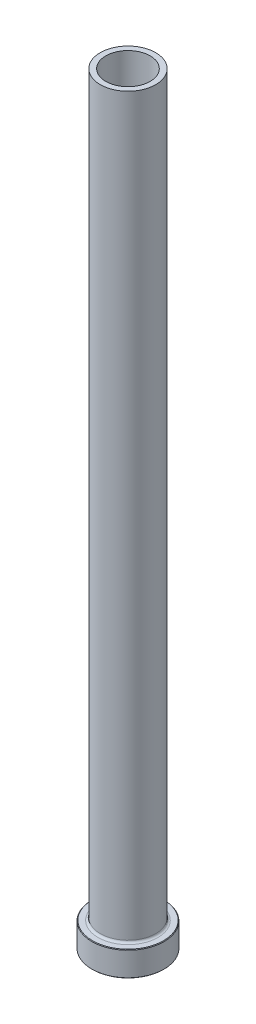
SolidWorks part; units mm, degrees
ref_plane "Front Plane" through (0, 0, 0) normal (0, 0, 1) x (1, 0, 0)
ref_plane "Top Plane" through (0, 0, 0) normal (0, 1, 0) x (1, 0, 0)
ref_plane "Right Plane" through (0, 0, 0) normal (1, 0, 0) x (0, 0, -1)
sketch "Sketch1" plane through (0, 0, 0) normal (0, 0, 1) x (1, 0, 0)
  line L0 (-8, 275) -> (-10, 275)
  line L1 (-10, 275) -> (-10, 9)
  line L2 (-10, 9) -> (-13, 9)
  line L3 (-13, 9) -> (-13, 0)
  line L4 (14.3, 0) -> (-14.3, 0) construction
  line L5 (-13, 0) -> (-8.25, 0)
  line L6 (-8, 220) -> (-8, 275)
  line L7 (0, 92.1877) -> (0, -15.5353) construction
  line L8 (0, -14.3) -> (0, 14.3) construction
  line L9 (-8, 220) -> (-8.25, 208)
  line L10 (-8.25, 208) -> (-8.25, 0)
  dimension "D1" = 0.25
  dimension "ID" = 16
  dimension "OD" = 20
  dimension "L" = 275
  dimension "H" = 26
  dimension "T" = 9
  dimension "N" = 55
  dimension "D2" = 12
revolve "Revolve1" add sketch "Sketch1" angle 360 about L7
fillet "Fillet1" radius 0.8 1 edges at (0, 9, 10)
chamfer "Chamfer1" distance 0.2 angle 45 2 edges at (0, 9, 13) (0, 0, 13)
chamfer "Chamfer3" distance 0.5 angle 45 1 edges at (0, 0, 8.25)
